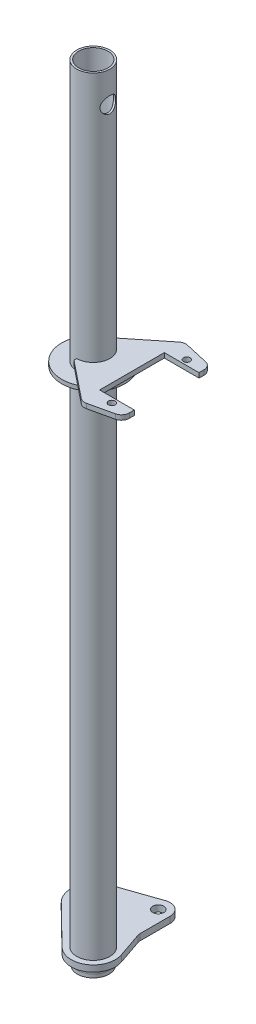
SolidWorks part; units mm, degrees
ref_plane "Plan de face" through (0, 0, 0) normal (0, 0, 1) x (1, 0, 0)
ref_plane "Plan de dessus" through (0, 0, 0) normal (0, 1, 0) x (1, 0, 0)
ref_plane "Plan de droite" through (0, 0, 0) normal (1, 0, 0) x (0, 0, -1)
sketch "Esquisse1" plane through (0, 0, 0) normal (0, 1, 0) x (1, 0, 0)
  line L0 (-57.9022, 78.2534) -> (-4.9011, 96.5767)
  line L1 (15, 82.4) -> (15, 44.3612)
  line L2 (15.5371, 41.128) -> (26.4961, 9.0529)
  line L3 (-19.5901, -20.0057) -> (-69.0894, 28.4653)
  circle A0 centre (0, 0) radius 21
  circle A1 centre (-48.1, 49.9) radius 15
  circle A2 centre (0, 82.4) radius 7
  arc A3 (-4.9011, 96.5767) -> (15, 82.4) centre (0, 82.4) cw
  arc A4 (26.4961, 9.0529) -> (-19.5901, -20.0057) centre (0, 0) cw
  arc A5 (-69.0894, 28.4653) -> (-57.9022, 78.2534) centre (-48.1, 49.9) cw
  arc A6 (15, 44.3612) -> (15.5371, 41.128) centre (25, 44.3612) ccw
  point P11 (15, 42.7)
  dimension "D1" = 30
  dimension "D2" = 42
  dimension "D3" = 14
  dimension "D4" = 15
  dimension "D5" = 28
  dimension "D6" = 30
  dimension "D12" = 10
  dimension "D7" = 49.9
  dimension "D8" = 48.1
  dimension "D9" = 48.1
  dimension "D10" = 82.4
  dimension "D11" = 42.7
extrude "Extrusion1" add sketch "Esquisse1" along normal blind 8
sketch "Esquisse2" plane through (0, 0, 0) normal (1, 0, 0) x (0, 0, -1)
  line L0 (0, -7) -> (0, 982)
  dimension "D1" = 7
  dimension "D2" = 989
other "Elément mécano-soudé1"
ref_plane "Plan1" through (0, -7, 0) normal (0, 1, 0) x (-1, 0, 0)
sketch "Esquisse11" plane through (0, -7, 0) normal (0, 1, 0) x (-1, 0, 0)
  line L0 (-21, 0) -> (21, 0) construction
  line L1 (0, 21) -> (0, -21) construction
  circle A0 centre (0, 0) radius 21
  circle A1 centre (0, 0) radius 18.5
  point P8 (0, 0)
  dimension "D1" = 37
  dimension "D2" = 42
inserted part "laser rondelle haut guidon"
move or copy body "Corps-Déplacer/Copier2" placed by mates yes
other "Distance1" parameters "D1"=638
other "<laser rondelle haut guidon>-<Extrusion1>"
sketch "Esquisse12" plane through (0, 8, 0) normal (0, 1, 0) x (-1, 0, 0)
  point P0 (48.1, -49.9)
ref_plane "Plan2" through (0, 0, 0) normal (-0.72, 0, 0.694) x (0.694, 0, 0.72)
sketch "Esquisse13" plane through (0, 0, 0) normal (-0.72, 0, 0.694) x (0.694, 0, 0.72)
  line L0 (-69.3082, -3) -> (-69.3082, 81)
  dimension "D1" = 11
  dimension "D2" = 73
other "Elément mécano-soudé2"
ref_plane "Plan3" through (-48.1, -3, -49.9) normal (0, 1, 0) x (-1, 0, 0)
sketch "Esquisse14" plane through (-48.1, -3, -49.9) normal (0, 1, 0) x (-1, 0, 0)
  line L0 (-15, 0) -> (15, 0) construction
  line L1 (0, 15) -> (0, -15) construction
  circle A0 centre (0, 0) radius 15
  point P7 (0, 0)
  dimension "D1" = 30
chamfer "Chanfrein1" distance 2 angle 45 1 edges at (-48.1, 81, -34.9)
sketch "Esquisse16" plane through (0, 0, 0) normal (1, 0, 0) x (0, 0, -1)
  line L0 (0, -7) -> (0, 982) construction
  line L1 (21, 982) -> (-21, 982) construction
  circle A0 centre (0, 943) radius 10
  dimension "D2" = 20
  dimension "D1" = 39
extrude "Enlèv. mat.-Extru.1" cut sketch "Esquisse16" against normal through all and the other way through all
inserted part "laser fix joystick"
move or copy body "Corps-Déplacer/Copier4" placed by mates yes
other "Distance3" parameters "D1"=7.3
other "<laser fix joystick>-<Extrusion1>"
sketch "Esquisse17" plane through (0, -7, 0) normal (0, -1, 0) x (1, 0, 0)
  circle A0 centre (0, 0) radius 20
  dimension "D1" = 40
extrude "Extrusion2" add sketch "Esquisse17" along normal blind 5 separate body
